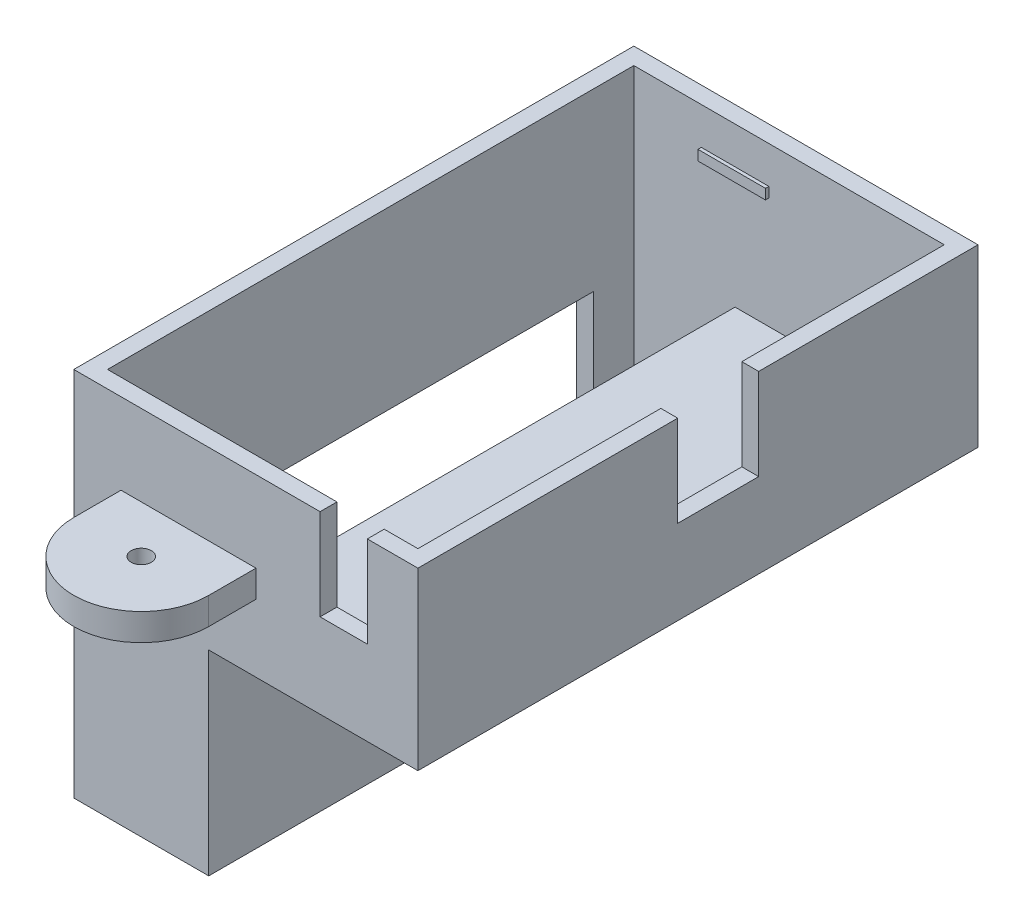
SolidWorks part; units mm, degrees
ref_plane "Front Plane" through (0, 0, 0) normal (0, 0, 1) x (1, 0, 0)
ref_plane "Top Plane" through (0, 0, 0) normal (0, 1, 0) x (1, 0, 0)
ref_plane "Right Plane" through (0, 0, 0) normal (1, 0, 0) x (0, 0, -1)
sketch "Sketch1" plane through (0, 0, 0) normal (0, 1, 0) x (1, 0, 0)
  line L0 (0, 45.7916) -> (0, 0) construction
  line L1 (0, 0) -> (50.9354, 0) construction
  line L3 (-25.5, 41.5) -> (25.5, 41.5)
  line L4 (-25.5, 41.5) -> (-25.5, -41.5)
  line L5 (-25.5, -41.5) -> (25.5, -41.5)
  line L6 (25.5, 41.5) -> (25.5, -41.5)
  dimension "D1" = 83
  dimension "D2" = 51
extrude "Boss-Extrude1" add sketch "Sketch1" along normal blind 55
sketch "Sketch2" plane through (0, 55, 0) normal (0, 1, 0) x (1, 0, 0)
  line L0 (-43.9119, 0) -> (40.413, 0) construction
  line L1 (25.5, 41.5) -> (-25.5, 41.5) construction
  line L2 (-25.5, -41.5) -> (25.5, -41.5) construction
  line L3 (-25.5, 41.5) -> (-25.5, -41.5) construction
  line L4 (-23, 39) -> (-8, 39)
  line L5 (-23, 39) -> (-23, -39)
  line L6 (-23, -39) -> (-8, -39)
  line L7 (-8, 39) -> (-8, -39)
  dimension "D1" = 15
  dimension "D2" = 2.5
  dimension "D3" = 2.5
  dimension "D4" = 2.5
extrude "Cut-Extrude1" cut sketch "Sketch2" against normal offset from surface (52.5 mm away) 2.5
sketch "Sketch3" plane through (0, 55, 0) normal (0, 1, 0) x (1, 0, 0)
  line L0 (25.5, -41.5) -> (25.5, 41.5) construction
  line L1 (-8, 39) -> (23, 39)
  line L2 (-8, 39) -> (-8, -39)
  line L3 (-8, -39) -> (23, -39)
  line L4 (23, 39) -> (23, -39)
  dimension "D1" = 2.5
extrude "Cut-Extrude2" cut sketch "Sketch3" against normal offset from surface (23.5 mm away) 31.5
sketch "Sketch4" plane through (-25.5, 0, 0) normal (-1, 0, 0) x (0, 0, 1)
  line L0 (39, 2.5) -> (39, 55) construction
  line L1 (24, 29) -> (-33, 29)
  line L2 (24, 29) -> (24, 10)
  line L3 (24, 10) -> (-33, 10)
  line L4 (-33, 29) -> (-33, 10)
  line L5 (39, 31.5) -> (-39, 31.5) construction
  dimension "D1" = 15
  dimension "D2" = 57
  dimension "D3" = 19
  dimension "D4" = 2.5
extrude "Cut-Extrude3" cut sketch "Sketch4" against normal up to surface (2.5 mm away)
sketch "Sketch5" plane through (25.5, 0, 0) normal (1, 0, 0) x (0, 0, -1)
  line L0 (-39, 31.5) -> (-39, 55) construction
  line L1 (-3, 55) -> (9, 55)
  line L2 (-3, 55) -> (-3, 41.5)
  line L3 (-3, 41.5) -> (9, 41.5)
  line L4 (9, 55) -> (9, 41.5)
  line L5 (39, 31.5) -> (-39, 31.5) construction
  line L6 (-41.5, 55) -> (41.5, 55) construction
  dimension "D1" = 48
  dimension "D2" = 12
  dimension "D3" = 10
extrude "Cut-Extrude4" cut sketch "Sketch5" against normal up to surface (2.5 mm away)
sketch "Sketch6" plane through (0, 0, 41.5) normal (0, 0, 1) x (1, 0, 0)
  line L0 (-25.5, 55) -> (25.5, 55) construction
  line L1 (18, 41.5) -> (11, 41.5)
  line L2 (18, 41.5) -> (18, 55)
  line L3 (18, 55) -> (11, 55)
  line L4 (11, 41.5) -> (11, 55)
  line L5 (23, 31.5) -> (23, 55) construction
  line L6 (23, 41.5) -> (25.5, 41.5) construction
  dimension "D1" = 5
  dimension "D2" = 7
extrude "Cut-Extrude5" cut sketch "Sketch6" against normal up to surface (2.5 mm away)
sketch "Sketch7" plane through (0, 0, -39) normal (0, 0, 1) x (1, 0, 0)
  line L0 (-25.5, 55) -> (11, 55) construction
  line L1 (-12.9963, 49.5) -> (-2.9963, 49.5)
  line L2 (-12.9963, 49.5) -> (-12.9963, 48)
  line L3 (-12.9963, 48) -> (-2.9963, 48)
  line L4 (-2.9963, 49.5) -> (-2.9963, 48)
  dimension "D1" = 1.5
  dimension "D2" = 5.5
  dimension "D3" = 10
extrude "Boss-Extrude2" add sketch "Sketch7" along normal blind 0.5
sketch "Sketch8" plane through (0, 0, 39) normal (0, 0, -1) x (-1, 0, 0)
  line L1 (2.9963, 49.5) -> (12.9963, 49.5)
  line L2 (2.9963, 49.5) -> (2.9963, 48)
  line L3 (2.9963, 48) -> (12.9963, 48)
  line L4 (12.9963, 49.5) -> (12.9963, 48)
extrude "Boss-Extrude3" add sketch "Sketch8" along normal blind 0.5
sketch "Sketch10" plane through (0, 0, 0) normal (0, -1, 0) x (1, 0, 0)
  line L1 (-5.5, 41.5) -> (25.5, 41.5)
  line L2 (-5.5, 41.5) -> (-5.5, -41.5)
  line L3 (-5.5, -41.5) -> (25.5, -41.5)
  line L4 (25.5, 41.5) -> (25.5, -41.5)
  line L5 (-25.5, 41.5) -> (25.5, 41.5) construction
  line L6 (25.5, -41.5) -> (-25.5, -41.5) construction
  line L7 (-8, -39) -> (-8, 39) construction
  dimension "D1" = 2.5
extrude "Cut-Extrude6" cut sketch "Sketch10" against normal offset from surface (29 mm away) 2.5
sketch "Sketch11" plane through (0, 55, 0) normal (0, 1, 0) x (1, 0, 0)
  line L0 (-25.5, -41.5) -> (11, -41.5) construction
  line L1 (-18.5, -41.5) -> (1.5, -41.5)
  line L2 (-18.5, -41.5) -> (-18.5, -48.5)
  line L4 (1.5, -41.5) -> (1.5, -48.5)
  line L5 (-25.5, 41.5) -> (-25.5, -41.5) construction
  arc A0 (-18.5, -48.5) -> (1.5, -48.5) centre (-8.5, -48.5) ccw
  circle A1 centre (-8.5, -48.5) radius 1.5
  dimension "D4" = 3
  dimension "D1" = 20
  dimension "D2" = 7
  dimension "D3" = 7
extrude "Boss-Extrude4" add sketch "Sketch11" against normal blind 16
sketch "Sketch12" plane through (1.5, 0, 0) normal (1, 0, 0) x (0, 0, -1)
  line L0 (-58.5, 55) -> (-58.5, 39) construction
  line L1 (-41.5, 55) -> (-58.5, 55)
  line L2 (-41.5, 55) -> (-41.5, 43)
  line L3 (-41.5, 43) -> (-58.5, 43)
  line L4 (-58.5, 55) -> (-58.5, 43)
  dimension "D1" = 12
extrude "Cut-Extrude7" cut sketch "Sketch12" against normal up to surface (20 mm away)
